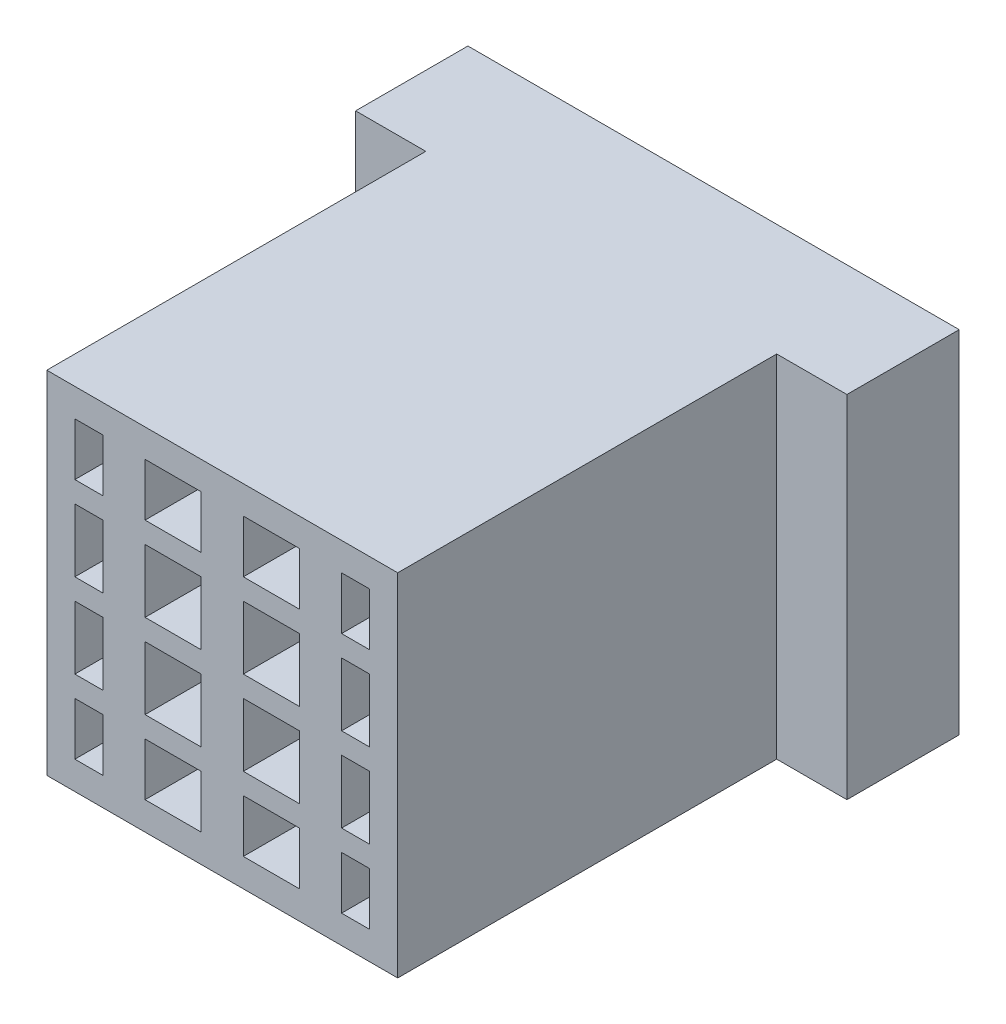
SolidWorks part; units mm, degrees
ref_plane "前视基准面" through (0, 0, 0) normal (0, 0, 1) x (1, 0, 0)
ref_plane "上视基准面" through (0, 0, 0) normal (0, 1, 0) x (1, 0, 0)
ref_plane "右视基准面" through (0, 0, 0) normal (1, 0, 0) x (0, 0, -1)
sketch "草图8" plane through (0, 0, 0) normal (0, 0, 1) x (1, 0, 0)
  line L0 (0, 7.8741) -> (0, -9.2542) construction
  line L1 (-12.5, -12.5) -> (12.5, -12.5)
  line L2 (-12.5, -12.5) -> (-12.5, 12.5)
  line L3 (-12.5, 12.5) -> (12.5, 12.5)
  line L4 (12.5, -12.5) -> (12.5, 12.5)
  line L5 (-12.5, -12.5) -> (12.5, 12.5) construction
  line L6 (-12.5, 12.5) -> (12.5, -12.5) construction
  line L7 (-16.0619, 0) -> (15.5648, 0) construction
  line L8 (-3.5, 7.8741) -> (-3.5, -9.2542) construction
  line L9 (-9.5, 7.8741) -> (-9.5, -9.2542) construction
  line L10 (5.5, 10.5) -> (1.5, 10.5)
  line L15 (-5.5, -10.5) -> (-1.5, -10.5)
  line L20 (-5.5, -10.5) -> (-5.5, 10.5)
  line L21 (-5.5, 10.5) -> (-1.5, 10.5)
  line L26 (-1.5, -10.5) -> (-1.5, 10.5)
  line L27 (-5.5, -10.5) -> (-1.5, 10.5) construction
  line L28 (-5.5, 10.5) -> (-1.5, -10.5) construction
  line L29 (-10.5, -10.5) -> (-8.5, -10.5)
  line L30 (-10.5, -10.5) -> (-10.5, 10.5)
  line L31 (-10.5, 10.5) -> (-8.5, 10.5)
  line L32 (-8.5, -10.5) -> (-8.5, 10.5)
  line L33 (-10.5, -10.5) -> (-8.5, 10.5) construction
  line L34 (-10.5, 10.5) -> (-8.5, -10.5) construction
  line L35 (1.5, -10.5) -> (1.5, 10.5)
  line L36 (5.5, -10.5) -> (1.5, -10.5)
  line L37 (5.5, -10.5) -> (5.5, 10.5)
  line L38 (10.5, 10.5) -> (8.5, 10.5)
  line L39 (8.5, -10.5) -> (8.5, 10.5)
  line L40 (10.5, -10.5) -> (8.5, -10.5)
  line L41 (10.5, -10.5) -> (10.5, 10.5)
  point P0 (0, 0)
  point P14 (-7, 0)
  point P15 (-3.5, 0)
  point P17 (-3, 0)
  point P21 (-9.5, 0)
  point P22 (-9, 0)
  dimension "D1" = 3.5
  dimension "D2" = 6
extrude "凸台-拉伸7" add sketch "草图8" along normal blind 25
sketch "草图9" plane through (0, 0, 0) normal (0, 0, -1) x (-1, 0, 0)
  line L1 (-12.5, -12.5) -> (12.5, -12.5)
  line L2 (-12.5, -12.5) -> (-12.5, 12.5)
  line L3 (-12.5, 12.5) -> (12.5, 12.5)
  line L4 (12.5, -12.5) -> (12.5, 12.5)
  line L5 (-12.5, -12.5) -> (12.5, 12.5) construction
  line L6 (-12.5, 12.5) -> (12.5, -12.5) construction
  point P0 (0, 0)
extrude "凸台-拉伸8" add sketch "草图9" along normal blind 2
sketch "草图11" plane through (0, 0, -2) normal (0, 0, -1) x (-1, 0, 0)
  line L5 (-17.5, -12.5) -> (17.5, -12.5)
  line L6 (-17.5, -12.5) -> (-17.5, 12.5)
  line L7 (-17.5, 12.5) -> (17.5, 12.5)
  line L8 (17.5, -12.5) -> (17.5, 12.5)
  line L9 (-17.5, -12.5) -> (17.5, 12.5) construction
  line L10 (-17.5, 12.5) -> (17.5, -12.5) construction
  point P0 (0, 0)
extrude "凸台-拉伸9" add sketch "草图11" along normal blind 6
sketch "草图12" plane through (0, 0, -8) normal (0, 0, -1) x (-1, 0, 0)
  line L1 (-15, -10.5) -> (15, -10.5)
  line L2 (-15, -10.5) -> (-15, 10.5)
  line L3 (-15, 10.5) -> (15, 10.5)
  line L4 (15, -10.5) -> (15, 10.5)
  line L5 (-15, -10.5) -> (15, 10.5) construction
  line L6 (-15, 10.5) -> (15, -10.5) construction
  point P0 (0, 0)
extrude "切除-拉伸1" cut sketch "草图12" against normal blind 4
sketch "草图14" plane through (0, 0, 25) normal (0, 0, 1) x (1, 0, 0)
  line L0 (-16.6961, 0) -> (20.7273, 0) construction
  line L1 (-12.5, 12.5) -> (-12.5, -12.5) construction
  line L2 (12.5, -0.75) -> (-12.5, -0.75)
  line L3 (12.5, -0.75) -> (12.5, 0.75)
  line L4 (12.5, 0.75) -> (-12.5, 0.75)
  line L5 (-12.5, -0.75) -> (-12.5, 0.75)
  line L6 (12.5, -0.75) -> (-12.5, 0.75) construction
  line L7 (12.5, 0.75) -> (-12.5, -0.75) construction
  line L12 (12.5, 5.25) -> (-12.5, 5.25)
  line L13 (12.5, 5.25) -> (12.5, 6.75)
  line L14 (12.5, 6.75) -> (-12.5, 6.75)
  line L15 (-12.5, 5.25) -> (-12.5, 6.75)
  line L16 (12.5, 5.25) -> (-12.5, 6.75) construction
  line L17 (12.5, 6.75) -> (-12.5, 5.25) construction
  line L18 (12.5, -6.75) -> (-12.5, -5.25) construction
  line L19 (12.5, -5.25) -> (-12.5, -6.75) construction
  line L20 (-12.5, -5.25) -> (-12.5, -6.75)
  line L21 (12.5, -6.75) -> (-12.5, -6.75)
  line L22 (12.5, -5.25) -> (12.5, -6.75)
  line L23 (12.5, -5.25) -> (-12.5, -5.25)
  point P3 (0, 0)
  point P11 (0, 6)
  point P19 (0, -6)
  dimension "D1" = 2
extrude "凸台-拉伸11" add sketch "草图14" against normal blind 25
sketch "草图15" plane through (0, 0, -8) normal (0, 0, -1) x (-1, 0, 0)
  line L1 (-17.5, -12.5) -> (17.5, -12.5)
  line L2 (-17.5, -12.5) -> (-17.5, 12.5)
  line L3 (-17.5, 12.5) -> (17.5, 12.5)
  line L4 (17.5, -12.5) -> (17.5, 12.5)
  line L5 (-17.5, -12.5) -> (17.5, 12.5) construction
  line L6 (-17.5, 12.5) -> (17.5, -12.5) construction
  point P0 (0, 0)
extrude "凸台-拉伸12" add sketch "草图15" along normal blind 2
